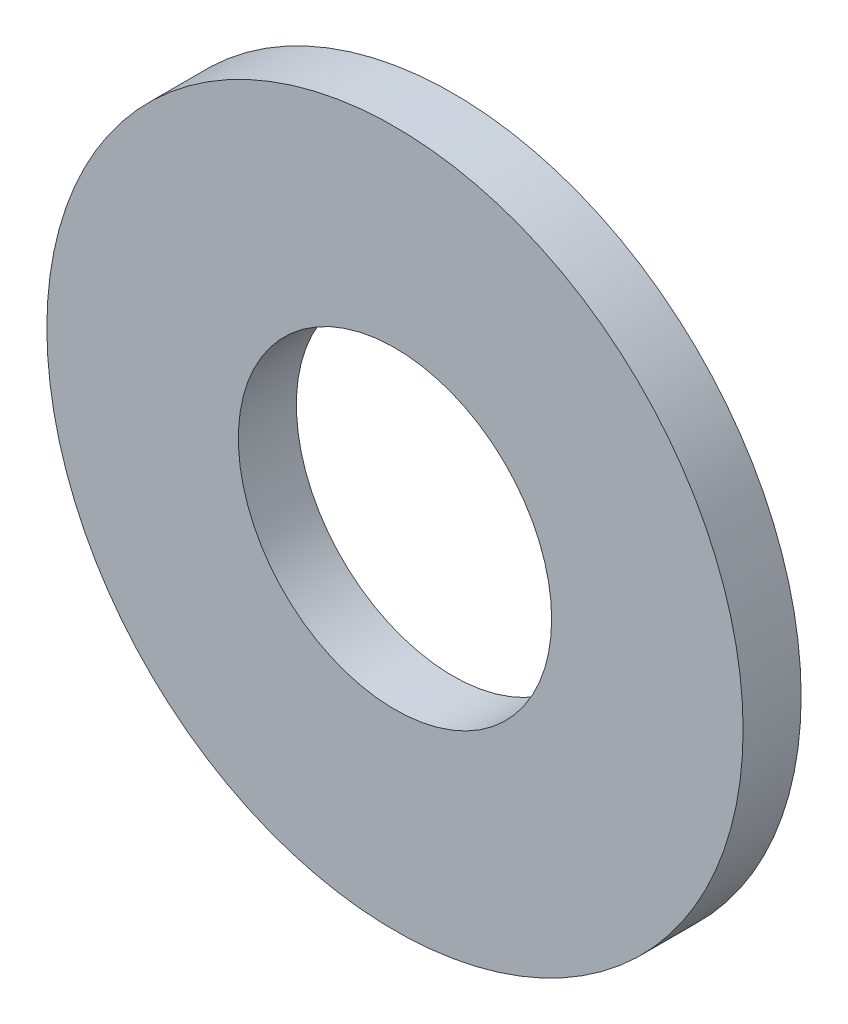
SolidWorks part; units mm, degrees
ref_plane "Front" through (0, 0, 0) normal (0, 0, 1) x (1, 0, 0)
ref_plane "Top" through (0, 0, 0) normal (0, 1, 0) x (1, 0, 0)
ref_plane "Right" through (0, 0, 0) normal (1, 0, 0) x (0, 0, -1)
other "Configuration Table"
sketch "Sketch1" plane through (0, 0, 0) normal (0, 0, 1) x (1, 0, 0)
  circle A0 centre (0, 0) radius 1.35
  circle A1 centre (0, 0) radius 3
  dimension "d1" = 2.7
  dimension "d2" = 6
extrude "Base-Extrude" add sketch "Sketch1" against normal blind 0.5
